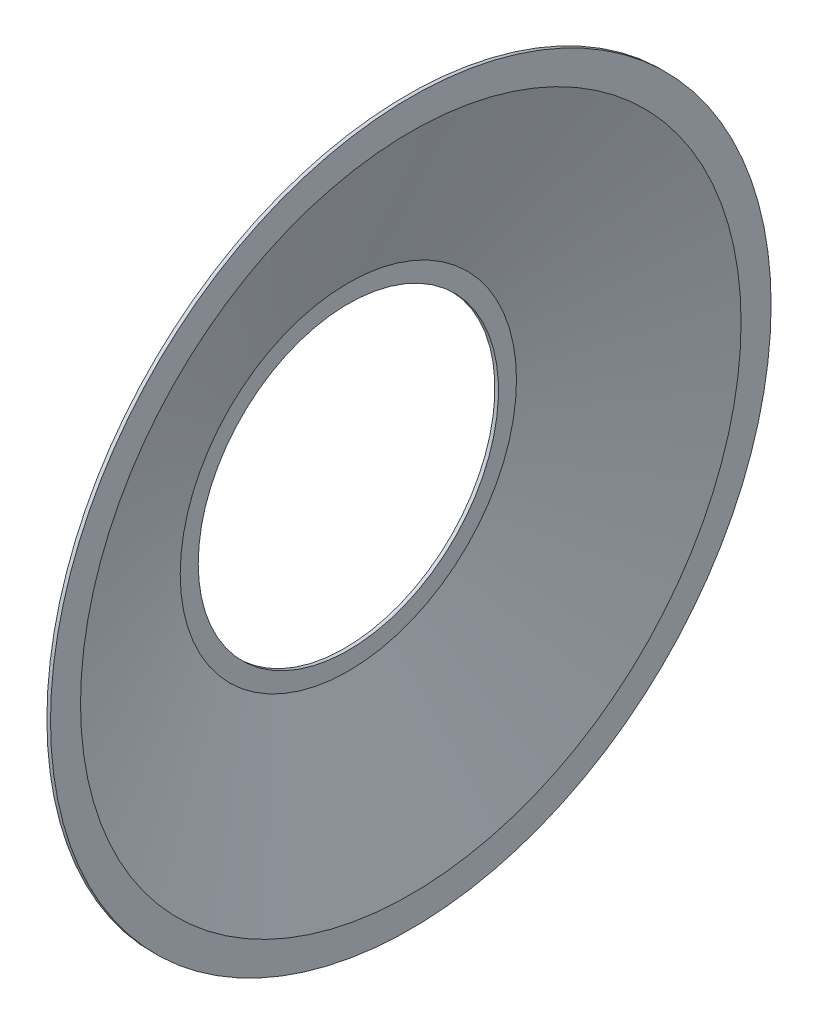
SolidWorks part; units mm, degrees
ref_plane "Спереди" through (0, 0, 0) normal (0, 0, 1) x (1, 0, 0)
ref_plane "Сверху" through (0, 0, 0) normal (0, 1, 0) x (1, 0, 0)
ref_plane "Справа" through (0, 0, 0) normal (1, 0, 0) x (0, 0, -1)
sketch "Эскиз1" plane through (0, 0, 0) normal (0, 0, 1) x (1, 0, 0)
  line L0 (0, 0) -> (65.3127, 0) construction
  line L1 (0.6, 25) -> (0, 25)
  line L2 (0.6, 25) -> (0.6, 28)
  line L3 (0, 25) -> (0, 28)
  line L4 (0, 28) -> (10.4, 55)
  line L5 (10.4, 55) -> (10.4, 60)
  line L6 (0.6, 28) -> (11, 55)
  line L7 (11, 55) -> (11, 60)
  line L8 (10.4, 60) -> (11, 60)
  dimension "D1" = 10.4
  dimension "D2" = 60
  dimension "D3" = 5
  dimension "D4" = 25
  dimension "D5" = 3
  dimension "D6" = 0.6
revolve "Повернуть1" add sketch "Эскиз1" angle 360 about L0
